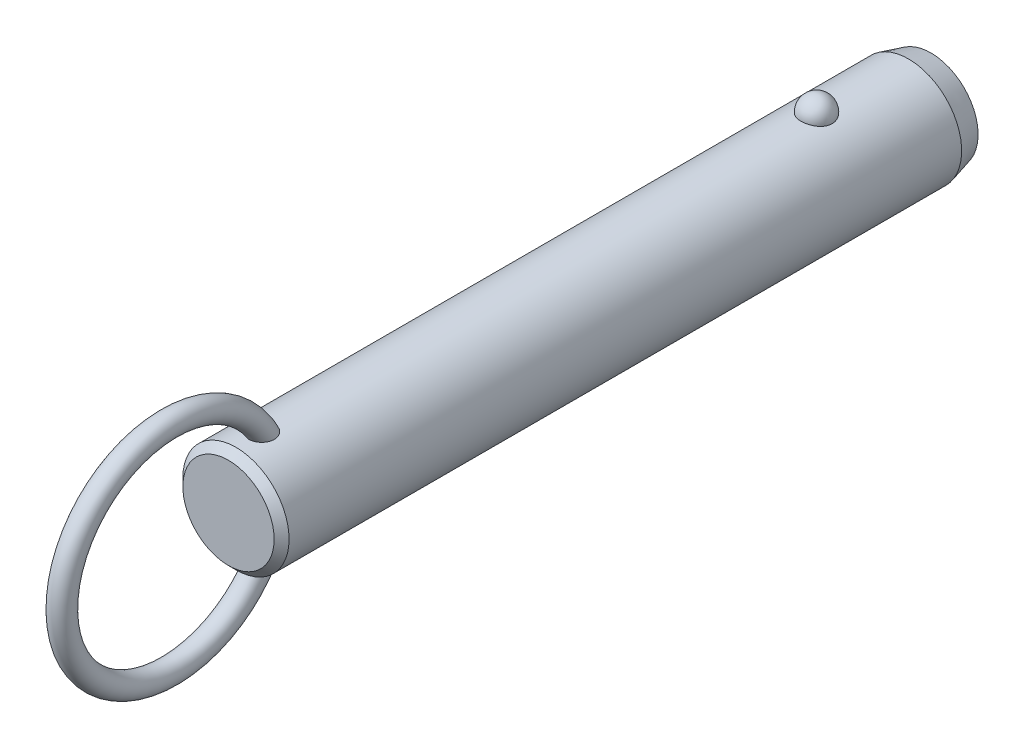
SolidWorks part; units mm, degrees
ref_plane "Front Plane" through (0, 0, 0) normal (0, 0, 1) x (1, 0, 0)
ref_plane "Top Plane" through (0, 0, 0) normal (0, 1, 0) x (1, 0, 0)
ref_plane "Right Plane" through (0, 0, 0) normal (1, 0, 0) x (0, 0, -1)
sketch "Sketch2" plane through (0, 0, 0) normal (0, 0, 1) x (1, 0, 0)
  circle A0 centre (0, 0) radius 7.1
  point P3 (0, 7.1)
  dimension "D1" = 14.2
extrude "Boss-Extrude1" add sketch "Sketch2" along normal blind 68.6
sketch "Sketch3" plane through (0, 0, 0) normal (0, 0, -1) x (-1, 0, 0)
  circle A0 centre (0, 0) radius 7.1
  dimension "D1" = 14.2
extrude "Boss-Extrude2" add sketch "Sketch3" along normal blind 17.4
chamfer "Chamfer1" distance 3 angle 15 1 edges at (-7.1, 0, -17.4)
sketch "Sketch12" plane through (0, 0, 0) normal (1, 0, 0) x (0, 0, -1)
  line L0 (-68.6, 7.1) -> (-68.6, -7.1) construction
  point P0 (-68.6, 0)
sketch "Sketch13" plane through (0, 0, 0) normal (1, 0, 0) x (0, 0, -1)
  circle A0 centre (-84.45, 0) radius 15.85
  point P2 (-68.6, 0)
  dimension "D1" = 31.7
sketch "Sketch14" plane through (0, 0, 0) normal (0, 1, 0) x (1, 0, 0)
  circle A0 centre (0, -70.1) radius 1.5
  point P2 (0, -68.6)
  dimension "D1" = 3
sweep "Sweep1" add profiles "Sketch14" path "Sketch13"
sketch "Sketch15" plane through (0, 0, 68.6) normal (0, 0, 1) x (1, 0, 0)
  circle A0 centre (0, 0) radius 7.1
  dimension "D1" = 14.2
extrude "Boss-Extrude3" add sketch "Sketch15" along normal blind 7.92
chamfer "Chamfer2" distance 1 angle 45 1 edges at (7.1, 0, 76.52)
sketch "Sketch18" plane through (0, 0, 0) normal (1, 0, 0) x (0, 0, -1)
  line L0 (14.4, 7.1) -> (-70.2792, 7.1) construction
  line L1 (2.1, 9.2) -> (2.1, 5)
  line L2 (-70.2792, -7.1) -> (14.4, -7.1) construction
  arc A0 (2.1, 9.2) -> (2.1, 5) centre (2.1, 7.1) ccw
  point P4 (0, 7.1)
  dimension "D1" = 16.3
revolve "Revolve1" add sketch "Sketch18" angle 360 about L1
